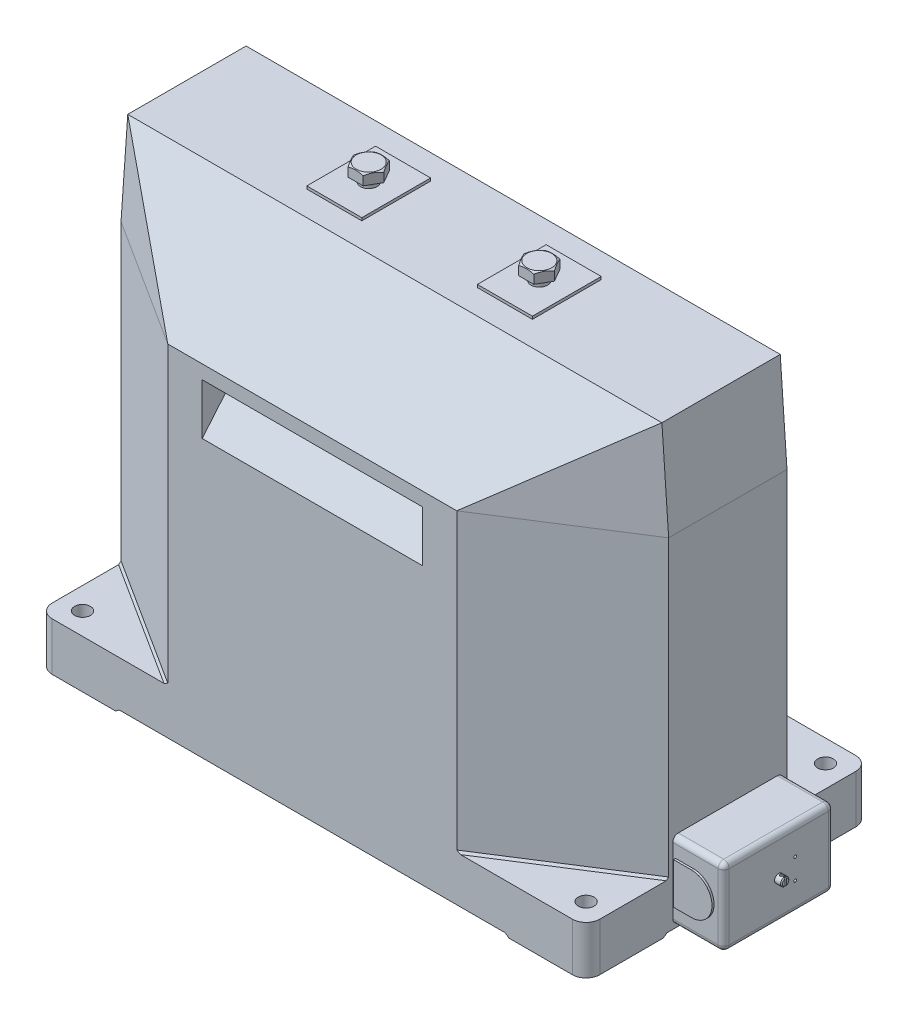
SolidWorks part; units mm, degrees
ref_plane "Front Plane" through (0, 0, 0) normal (0, 0, 1) x (1, 0, 0)
ref_plane "Top Plane" through (0, 0, 0) normal (0, 1, 0) x (1, 0, 0)
ref_plane "Right Plane" through (0, 0, 0) normal (1, 0, 0) x (0, 0, -1)
other "Join1"
other "21105-115_PlombaCsavar<1>@24305_AM-40b_Körvonalrajzhoz"
other "FME12_Tömszelence_29519_112<1>@24305_AM-40b_Körvonalrajzhoz"
other "FME12_Tömszelence_29519_112<2>@24305_AM-40b_Körvonalrajzhoz"
other "HlTmCsDIN933<1>@24305_AM-40b_Körvonalrajzhoz"
other "HlTmCsDIN933<3>@24305_AM-40b_Körvonalrajzhoz"
other "HlTmCsDIN933<2>@24305_AM-40b_Körvonalrajzhoz"
other "FME12_TRA_Kapocsfedél_29519_113<1>@24305_AM-40b_Körvonalrajzhoz"
other "AM40b_TRA_Kiöntött_Körvonalrajzhoz<1>@24305_AM-40b_Körvonalrajzhoz/AM40b_TRA_Test_T24305<1>@AM40b_TRA_Kiöntött_Körvonalrajzhoz"
